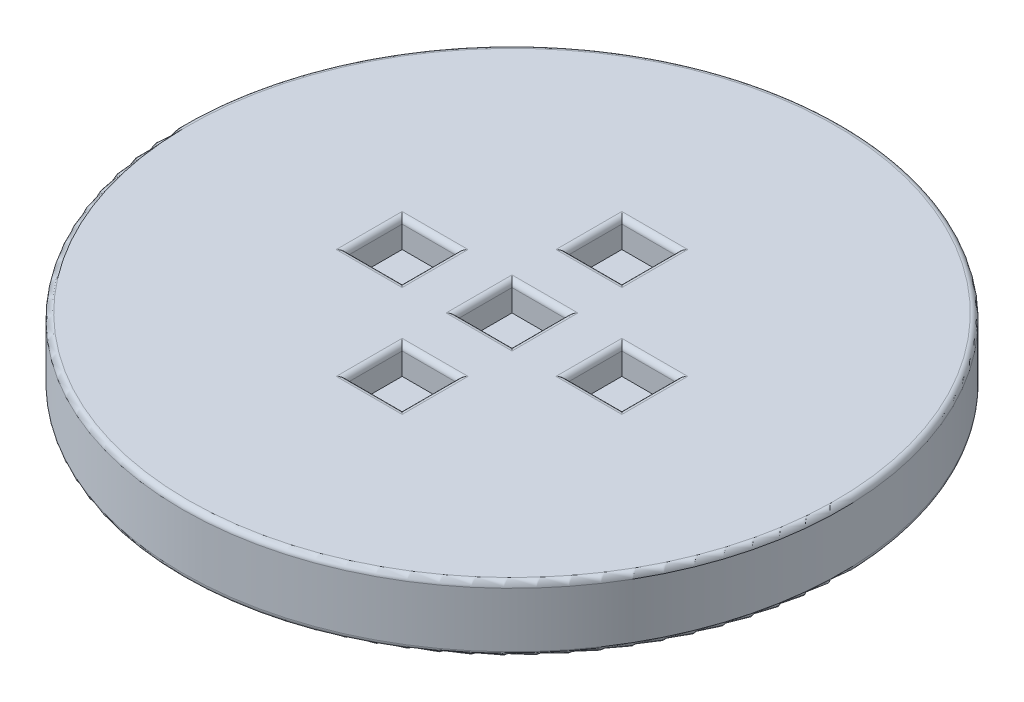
SolidWorks part; units mm, degrees
ref_plane "Front Plane" through (0, 0, 0) normal (0, 0, 1) x (1, 0, 0)
ref_plane "Top Plane" through (0, 0, 0) normal (0, 1, 0) x (1, 0, 0)
ref_plane "Right Plane" through (0, 0, 0) normal (1, 0, 0) x (0, 0, -1)
sketch "Sketch1" plane through (0, 0, 0) normal (0, 1, 0) x (1, 0, 0)
  circle A0 centre (0, 0) radius 30
extrude "Boss-Extrude1" add sketch "Sketch1" along normal blind 6
sketch "Sketch2" plane through (0, 6, 0) normal (0, 1, 0) x (1, 0, 0)
  line L0 (0, 0) -> (0, -10) construction
  line L1 (0, 0) -> (10, 0) construction
  line L2 (0, 0) -> (-10, 0) construction
  line L3 (0, 0) -> (0, 10) construction
  line L5 (-2.5, -7.5) -> (2.5, -7.5)
  line L6 (-2.5, -7.5) -> (-2.5, -12.5)
  line L7 (-2.5, -12.5) -> (2.5, -12.5)
  line L8 (2.5, -7.5) -> (2.5, -12.5)
  line L9 (-2.5, -7.5) -> (2.5, -12.5) construction
  line L10 (-2.5, -12.5) -> (2.5, -7.5) construction
  line L11 (-7.5, -2.5) -> (-12.5, -2.5)
  line L12 (-7.5, -2.5) -> (-7.5, 2.5)
  line L13 (-7.5, 2.5) -> (-12.5, 2.5)
  line L14 (-12.5, -2.5) -> (-12.5, 2.5)
  line L15 (-7.5, -2.5) -> (-12.5, 2.5) construction
  line L16 (-7.5, 2.5) -> (-12.5, -2.5) construction
  line L17 (2.5, -2.5) -> (-2.5, -2.5)
  line L18 (2.5, -2.5) -> (2.5, 2.5)
  line L19 (2.5, 2.5) -> (-2.5, 2.5)
  line L20 (-2.5, -2.5) -> (-2.5, 2.5)
  line L21 (2.5, -2.5) -> (-2.5, 2.5) construction
  line L22 (2.5, 2.5) -> (-2.5, -2.5) construction
  line L23 (-2.5, 12.5) -> (2.5, 12.5)
  line L24 (-2.5, 12.5) -> (-2.5, 7.5)
  line L25 (-2.5, 7.5) -> (2.5, 7.5)
  line L26 (2.5, 12.5) -> (2.5, 7.5)
  line L27 (-2.5, 12.5) -> (2.5, 7.5) construction
  line L28 (-2.5, 7.5) -> (2.5, 12.5) construction
  line L29 (12.5, -2.5) -> (7.5, -2.5)
  line L30 (12.5, -2.5) -> (12.5, 2.5)
  line L31 (12.5, 2.5) -> (7.5, 2.5)
  line L32 (7.5, -2.5) -> (7.5, 2.5)
  line L33 (12.5, -2.5) -> (7.5, 2.5) construction
  line L34 (12.5, 2.5) -> (7.5, -2.5) construction
  dimension "D1" = 5
  dimension "D2" = 10
  dimension "D3" = 5
  dimension "D4" = 5
  dimension "D5" = 5
  dimension "D6" = 5
  dimension "D7" = 5
  dimension "D8" = 5
extrude "Cut-Extrude1" cut sketch "Sketch2" against normal blind 2.5
fillet "Fillet1" radius 0.5 6 edges at (2.5, 6, 0) (0, 6, 2.5) (-12.5, 6, 0) (-10, 6, 2.5) (-7.5, 6, 0) (-10, 6, -2.5)
sketch "Sketch3" plane through (0, 6, 0) normal (0, 1, 0) x (1, 0, 0)
sketch "Sketch4" plane through (0, 0, 0) normal (0, -1, 0) x (-1, 0, 0)
  line L0 (0, 0) -> (-10, 0) construction
  line L1 (0, 0) -> (0, -10) construction
  line L2 (0, 0) -> (0, 10) construction
  line L3 (0, 0) -> (10, 0) construction
  line L5 (-2.5, 2.5) -> (2.5, 2.5)
  line L6 (-2.5, 2.5) -> (-2.5, -2.5)
  line L7 (-2.5, -2.5) -> (2.5, -2.5)
  line L8 (2.5, 2.5) -> (2.5, -2.5)
  line L9 (-2.5, 2.5) -> (2.5, -2.5) construction
  line L10 (-2.5, -2.5) -> (2.5, 2.5) construction
  line L11 (-2.5, -7.5) -> (2.5, -7.5)
  line L12 (-2.5, -7.5) -> (-2.5, -12.5)
  line L13 (-2.5, -12.5) -> (2.5, -12.5)
  line L14 (2.5, -7.5) -> (2.5, -12.5)
  line L15 (-2.5, -7.5) -> (2.5, -12.5) construction
  line L16 (-2.5, -12.5) -> (2.5, -7.5) construction
  line L17 (7.5, 2.5) -> (12.5, 2.5)
  line L18 (7.5, 2.5) -> (7.5, -2.5)
  line L19 (7.5, -2.5) -> (12.5, -2.5)
  line L20 (12.5, 2.5) -> (12.5, -2.5)
  line L21 (7.5, 2.5) -> (12.5, -2.5) construction
  line L22 (7.5, -2.5) -> (12.5, 2.5) construction
  line L23 (-12.5, 2.5) -> (-7.5, 2.5)
  line L24 (-12.5, 2.5) -> (-12.5, -2.5)
  line L25 (-12.5, -2.5) -> (-7.5, -2.5)
  line L26 (-7.5, 2.5) -> (-7.5, -2.5)
  line L27 (-12.5, 2.5) -> (-7.5, -2.5) construction
  line L28 (-12.5, -2.5) -> (-7.5, 2.5) construction
  line L29 (2.5, 7.5) -> (-2.5, 7.5)
  line L30 (2.5, 7.5) -> (2.5, 12.5)
  line L31 (2.5, 12.5) -> (-2.5, 12.5)
  line L32 (-2.5, 7.5) -> (-2.5, 12.5)
  line L33 (2.5, 7.5) -> (-2.5, 12.5) construction
  line L34 (2.5, 12.5) -> (-2.5, 7.5) construction
  dimension "D1" = 5
  dimension "D2" = 5
  dimension "D3" = 5
  dimension "D4" = 5
  dimension "D5" = 5
  dimension "D6" = 5
extrude "Cut-Extrude2" cut sketch "Sketch4" against normal blind 2.5
fillet "Fillet2" radius 0.5 21 edges at (0, 0, 30) (2.5, 0, 0) (0, 0, 2.5) (-2.5, 0, 0) (0, 0, -2.5) (2.5, 0, 10) (0, 0, 12.5) (-2.5, 0, 10) (0, 0, 7.5) (-7.5, 0, 0) (-10, 0, 2.5) (-12.5, 0, 0) (-10, 0, -2.5) (12.5, 0, 0) (10, 0, 2.5) (7.5, 0, 0) (10, 0, -2.5) (-2.5, 0, -10) (0, 0, -12.5) (2.5, 0, -10) (0, 0, -7.5)
fillet "Fillet3" radius 0.5 15 edges at (0, 6, 30) (0, 6, 7.5) (-2.5, 6, 10) (0, 6, 12.5) (2.5, 6, 10) (-2.5, 6, 0.25) (0.25, 6, -2.5) (0, 6, -12.5) (-2.5, 6, -10) (0, 6, -7.5) (2.5, 6, -10) (10, 6, 2.5) (12.5, 6, 0) (10, 6, -2.5) (7.5, 6, 0)
sketch "Sketch5" plane through (0, 6, 0) normal (0, 1, 0) x (1, 0, 0)
  text T0 "<b>0</b>"
